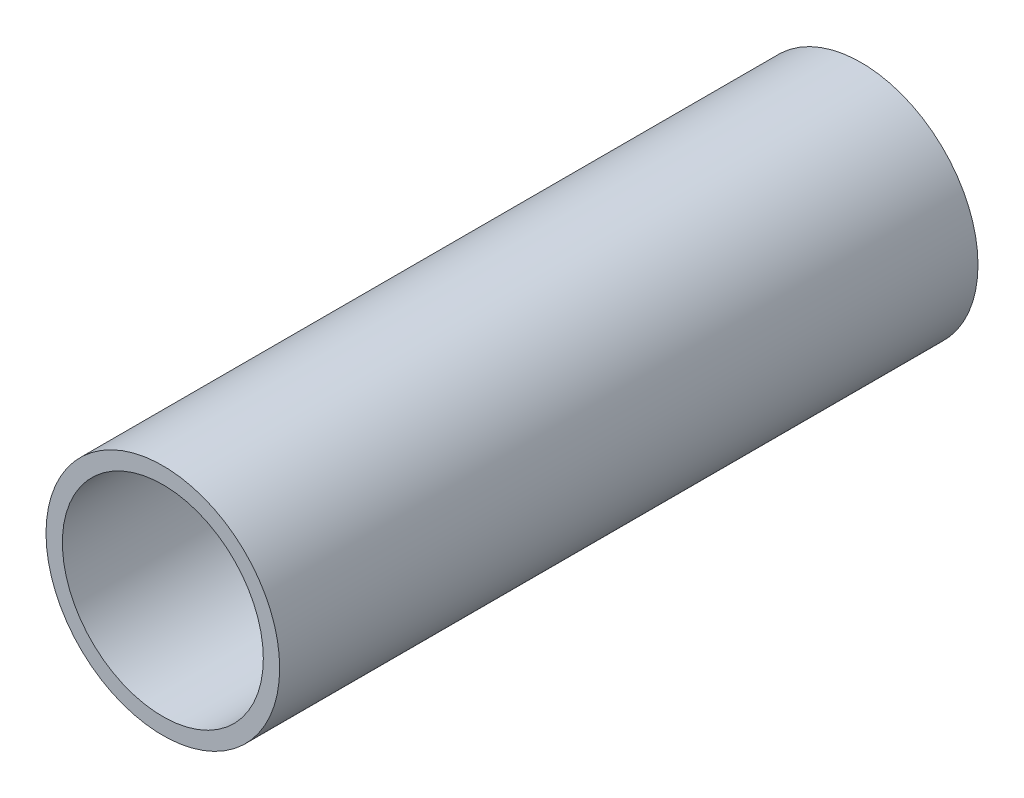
SolidWorks part; units mm, degrees
ref_plane "Front Plane" through (0, 0, 0) normal (0, 0, 1) x (1, 0, 0)
ref_plane "Top Plane" through (0, 0, 0) normal (0, 1, 0) x (1, 0, 0)
ref_plane "Right Plane" through (0, 0, 0) normal (1, 0, 0) x (0, 0, -1)
sketch "Sketch1" plane through (0, 0, 0) normal (0, 0, 1) x (1, 0, 0)
  circle A0 centre (0, 0) radius 8.5
  circle A1 centre (0, 0) radius 7.3094
  dimension "D1" = 17
  dimension "D2" = 1.1906
extrude "Boss-Extrude1" add sketch "Sketch1" along normal blind 50.8
